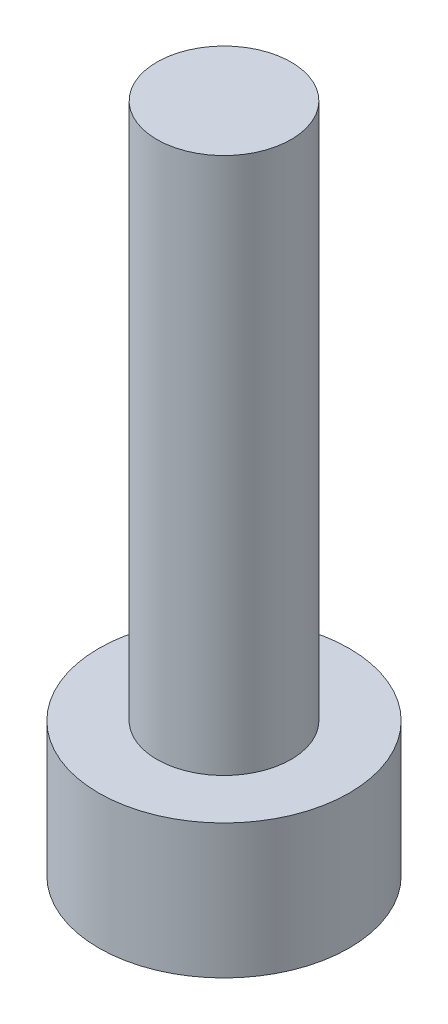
SolidWorks part; units mm, degrees
ref_plane "前视基准面" through (0, 0, 0) normal (0, 0, 1) x (1, 0, 0)
ref_plane "上视基准面" through (0, 0, 0) normal (0, 1, 0) x (1, 0, 0)
ref_plane "右视基准面" through (0, 0, 0) normal (1, 0, 0) x (0, 0, -1)
other "Configuration Table"
sketch "草图1" plane through (0, 0, 0) normal (0, 1, 0) x (1, 0, 0)
  circle A0 centre (0, 0) radius 2.8
  dimension "D1" = 5.6
extrude "凸台-拉伸1" add sketch "草图1" along normal blind 3
sketch "草图2" plane through (0, 3, 0) normal (0, 1, 0) x (1, 0, 0)
  circle A0 centre (0, 0) radius 1.5
  dimension "D1" = 3
extrude "凸台-拉伸2" add sketch "草图2" along normal blind 12
sketch "草图3" plane through (0, 0, 0) normal (0, -1, 0) x (1, 0, 0)
  line L1 (1.0846, -0.9524) -> (1.3671, 0.4631)
  line L2 (1.3671, 0.4631) -> (0.2825, 1.4155)
  line L3 (0.2825, 1.4155) -> (-1.0846, 0.9524)
  line L4 (-1.0846, 0.9524) -> (-1.3671, -0.4631)
  line L5 (-1.3671, -0.4631) -> (-0.2825, -1.4155)
  line L6 (-0.2825, -1.4155) -> (1.0846, -0.9524)
  circle A0 centre (0, 0) radius 1.25 construction
  dimension "D1" = 2.5
extrude "切除-拉伸1" cut sketch "草图3" against normal blind 1.5
